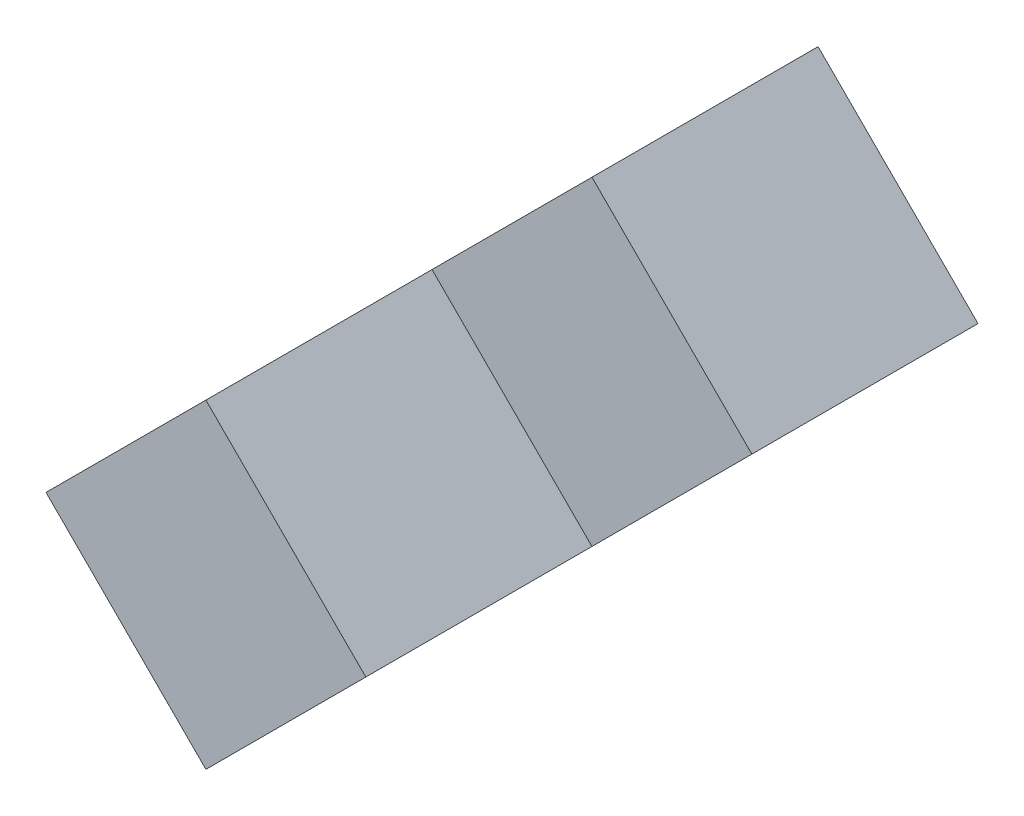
SolidWorks part; units mm, degrees
ref_plane "Alzado" through (0, 0, 0) normal (0, 0, 1) x (1, 0, 0)
ref_plane "Planta" through (0, 0, 0) normal (0, 1, 0) x (1, 0, 0)
ref_plane "Vista lateral" through (0, 0, 0) normal (1, 0, 0) x (0, 0, -1)
sketch "Croquis1" plane through (0, 0, 0) normal (0, 1, 0) x (1, 0, 0)
  line L0 (0, 55.3605) -> (0, -49.843) construction
ref_plane "Plano1" through (0, 0, 0) normal (-0.7071, 0.7071, 0) x (0, 0, 1)
sketch "Croquis2" plane through (0, 0, 0) normal (-0.7071, 0.7071, 0) x (0, 0, 1)
  line L0 (26.8039, 30) -> (26.8039, -30)
  line L3 (26.8039, 30) -> (46.8039, 30)
  line L4 (46.8039, 30) -> (46.8039, 10)
  line L5 (46.8039, 10) -> (66.8039, 10)
  line L6 (66.8039, 10) -> (66.8039, -10)
  line L8 (46.8039, -10) -> (66.8039, -10)
  line L9 (46.8039, -30) -> (46.8039, -10)
  line L10 (26.8039, -30) -> (46.8039, -30)
  dimension "D1" = 20
  dimension "D3" = 20
  dimension "D4" = 20
extrude "Extruir1" add sketch "Croquis2" along normal blind 20
